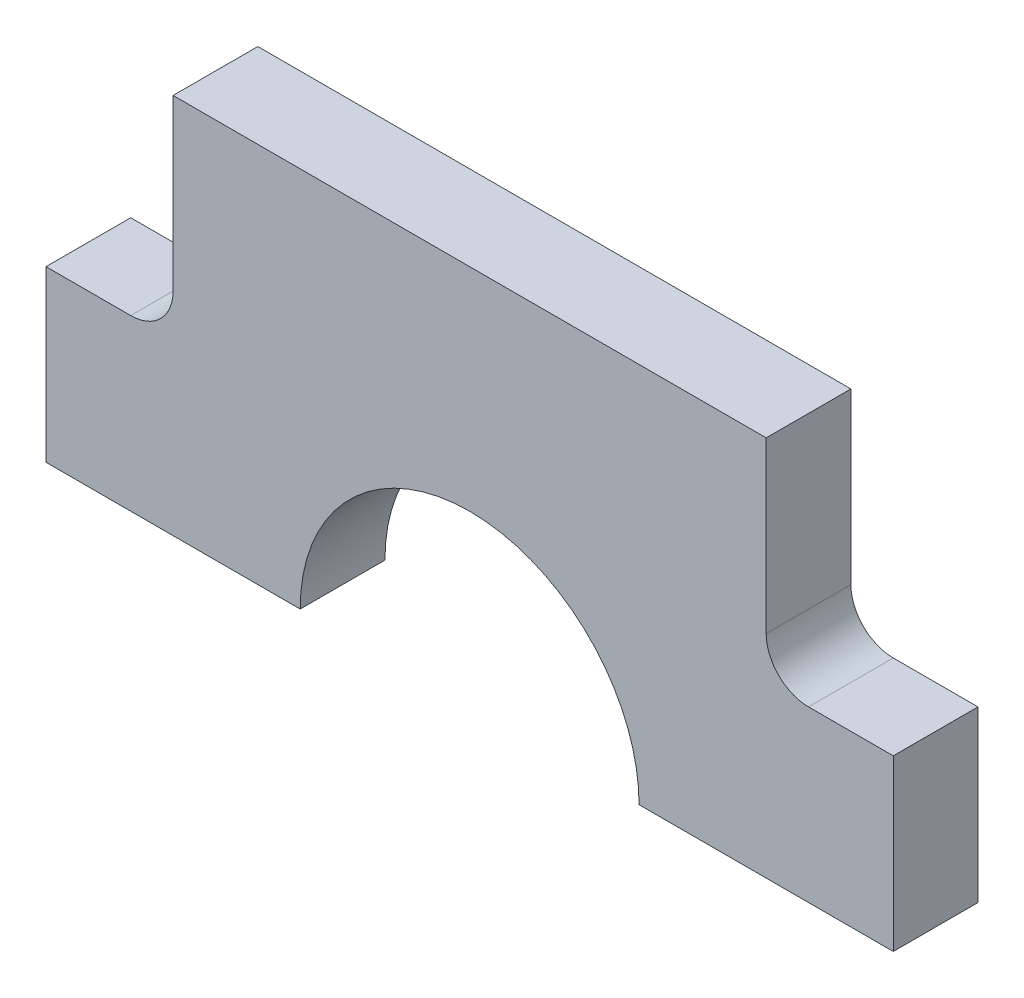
SolidWorks part; units mm, degrees
ref_plane "Front Plane" through (0, 0, 0) normal (0, 0, 1) x (1, 0, 0)
ref_plane "Top Plane" through (0, 0, 0) normal (0, 1, 0) x (1, 0, 0)
ref_plane "Right Plane" through (0, 0, 0) normal (1, 0, 0) x (0, 0, -1)
sketch "Sketch1" plane through (0, 0, 0) normal (0, 0, 1) x (1, 0, 0)
  line L0 (0, 0) -> (7.62, 0)
  line L1 (17.78, 0) -> (25.4, 0)
  line L2 (25.4, 0) -> (25.4, 5.08)
  line L3 (25.4, 5.08) -> (22.86, 5.08)
  line L4 (2.54, 5.08) -> (0, 5.08)
  line L5 (0, 5.08) -> (0, 0)
  line L6 (21.59, 6.35) -> (21.59, 11.43)
  line L7 (21.59, 11.43) -> (3.81, 11.43)
  line L8 (3.81, 11.43) -> (3.81, 6.35)
  arc A0 (7.62, 0) -> (17.78, 0) centre (12.7, 0) cw
  arc A1 (22.86, 5.08) -> (21.59, 6.35) centre (22.86, 6.35) cw
  arc A2 (2.54, 5.08) -> (3.81, 6.35) centre (2.54, 6.35) ccw
  point P14 (21.59, 5.08)
  dimension "D5" = 1.27
  dimension "D1" = 5.08
  dimension "D2" = 17.78
  dimension "D3" = 25.4
  dimension "D4" = 6.35
extrude "Boss-Extrude1" add sketch "Sketch1" along normal blind 2.54
